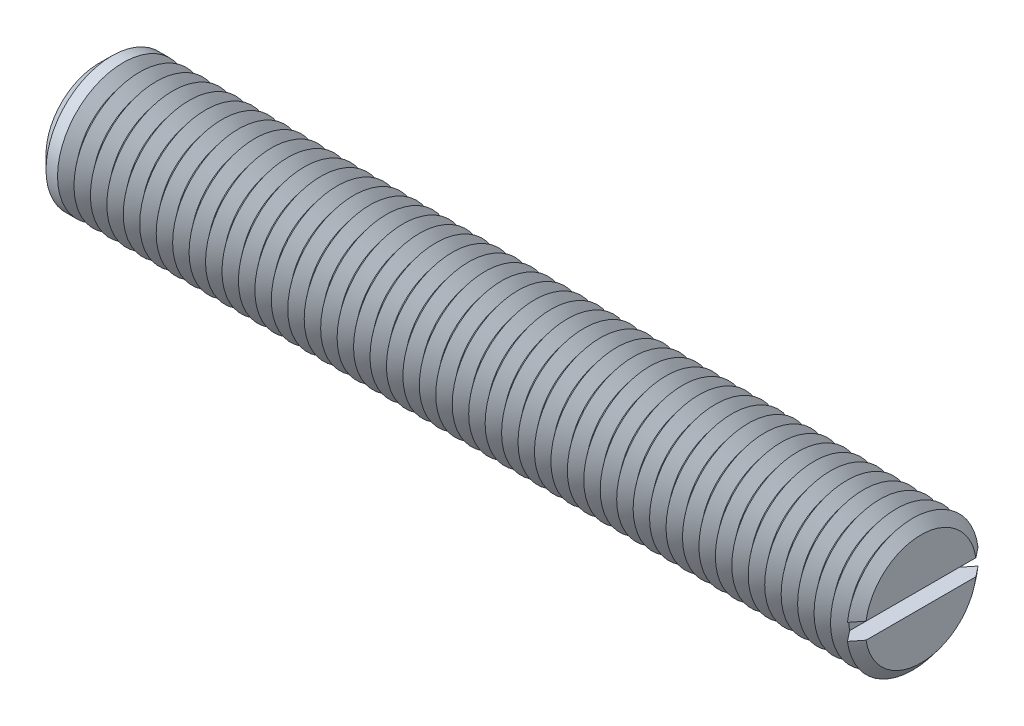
SolidWorks part; units mm, degrees
ref_plane "Front Plane" through (0, 0, 0) normal (0, 0, 1) x (1, 0, 0)
ref_plane "Top Plane" through (0, 0, 0) normal (0, 1, 0) x (1, 0, 0)
ref_plane "Right Plane" through (0, 0, 0) normal (1, 0, 0) x (0, 0, -1)
sketch "Sketch1" plane through (0, 0, 0) normal (1, 0, 0) x (0, 0, -1)
  circle A0 centre (0, 0) radius 8
  dimension "D1" = 16
extrude "Extrude1" add sketch "Sketch1" along normal mid plane 100
sketch "Sketch2" plane through (0, 0, 0) normal (0, 0, 1) x (1, 0, 0)
  line L0 (50, 1) -> (48, 1)
  line L1 (50, -8) -> (50, 8) construction
  line L2 (48, 1) -> (48, -1)
  line L3 (0, 0) -> (50000, 0) construction
  line L4 (50, -1) -> (48, -1)
  line L5 (50, -1) -> (50, 1)
  point P9 (48, 0)
  dimension "D1" = 2
extrude "Extrude2" cut sketch "Sketch2" against normal mid plane 24
chamfer "Chamfer1" distance 1.6 angle 45 1 edges at (-50, 0, -8)
sketch "Sketch3" plane through (0, 0, 0) normal (0, 0, 1) x (1, 0, 0)
  line L0 (0, 0) -> (30.9602, 0) construction
  line L1 (49, -8) -> (51, -8)
  line L2 (-48.4, -8) -> (50, -8) construction
  line L3 (51, -8) -> (50, -6.751)
  line L4 (50, -8) -> (50, -1) construction
  line L5 (50, -6.751) -> (49, -8)
  dimension "D1" = 2
  dimension "D2" = 1.6
revolve "Cut-Revolve1" cut sketch "Sketch3" angle 360 about L0
pattern_linear "LPattern1" count 49 spacing 2 along (-1, 0, 0) of "Cut-Revolve1"
equation "\"D2@Sketch3\" = \"D1@Sketch3\"*0.8"
